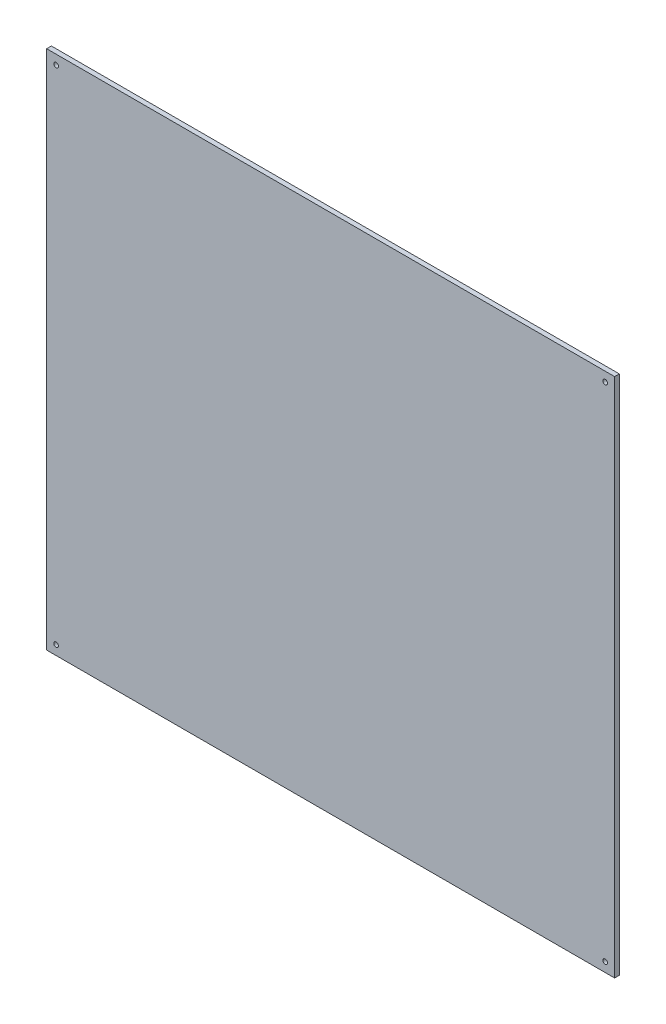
SolidWorks part; units mm, degrees
ref_plane "Front Plane" through (0, 0, 0) normal (0, 0, 1) x (1, 0, 0)
ref_plane "Top Plane" through (0, 0, 0) normal (0, 1, 0) x (1, 0, 0)
ref_plane "Right Plane" through (0, 0, 0) normal (1, 0, 0) x (0, 0, -1)
sketch "Sketch1" plane through (0, 0, 0) normal (0, 0, 1) x (1, 0, 0)
  line L0 (181, 332) -> (181, 0) construction
  line L1 (0, 0) -> (362, 0)
  line L2 (0, 0) -> (0, 332)
  line L3 (0, 332) -> (362, 332)
  line L4 (362, 0) -> (362, 332)
  line L5 (362, 166) -> (0, 166) construction
  circle A0 centre (356, 326) radius 1.5
  circle A1 centre (6, 326) radius 1.5
  circle A2 centre (6, 6) radius 1.5
  circle A3 centre (356, 6) radius 1.5
  dimension "D5" = 3
  dimension "D1" = 332
  dimension "D2" = 362
extrude "Boss-Extrude1" add sketch "Sketch1" along normal blind 3 contours L2 L3 L4 L1 | A1 | A0 | A3 | A2
